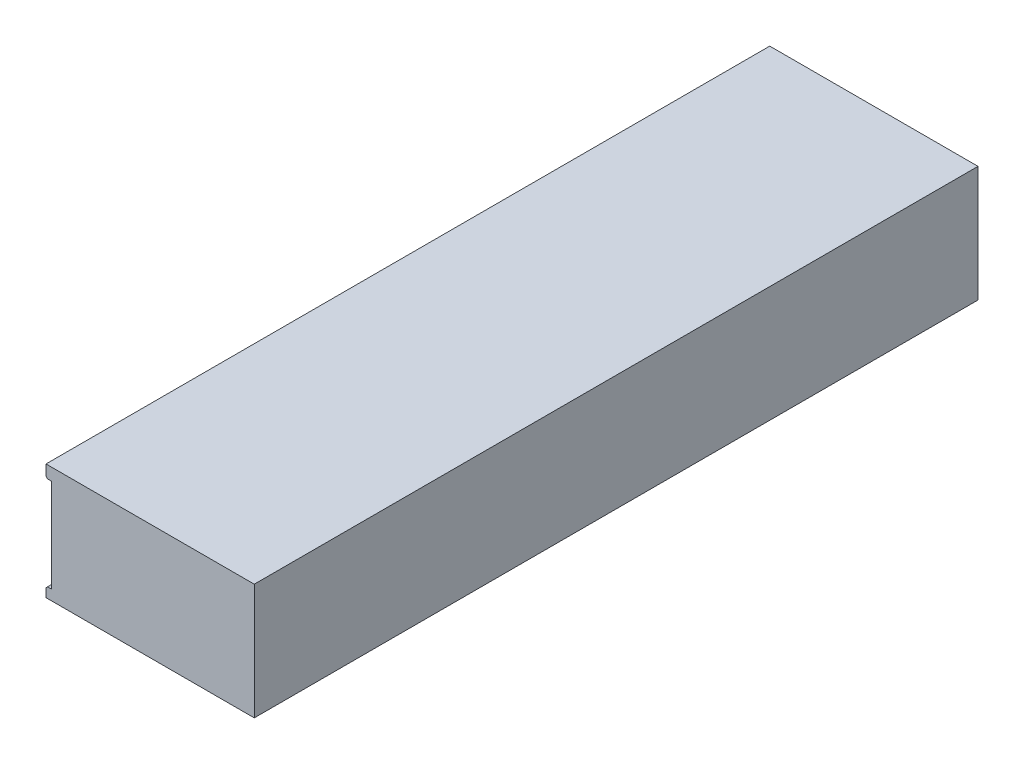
SolidWorks part; units mm, degrees
ref_plane "FRONT" through (0, 0, 0) normal (0, 0, 1) x (1, 0, 0)
ref_plane "TOP" through (0, 0, 0) normal (0, 1, 0) x (1, 0, 0)
ref_plane "RIGHT" through (0, 0, 0) normal (1, 0, 0) x (0, 0, -1)
sketch "Sketch1" plane through (0, 0, 0) normal (0, 0, 1) x (1, 0, 0)
  line L0 (50.673, 0) -> (50.673, -28.956)
  line L1 (50.673, -28.956) -> (-1.397, -28.956)
  line L2 (-1.397, -28.956) -> (-1.397, -26.416)
  line L3 (-1.397, -26.416) -> (0, -26.416)
  line L4 (0, -26.416) -> (0, -3.048)
  line L5 (0, -3.048) -> (-1.397, -3.048)
  line L6 (-1.397, -3.048) -> (-1.397, 0)
  line L7 (-1.397, 0) -> (50.673, 0)
  dimension "D1" = 52.07
  dimension "D2" = 50.673
  dimension "D3" = 3.048
  dimension "D4" = 2.54
  dimension "D5" = 28.956
extrude "Extrude1" add sketch "Sketch1" along normal mid plane 180.9496
sketch "Sketch2" plane through (0, 0, 0) normal (-1, 0, 0) x (0, 0, 1)
  line L1 (0, 0) -> (0, -28.956) construction
  line L2 (90.4748, -28.956) -> (-90.4748, -28.956) construction
  line L3 (0, -14.478) -> (26.0126, -14.478) construction
  point P0 (-85.598, -6.35)
  point P1 (85.598, -6.35)
  point P2 (4.8768, -6.35)
  point P4 (-4.8768, -6.35)
  point P9 (-4.8768, -23.114)
  point P12 (4.8768, -23.114)
  point P13 (85.598, -23.114)
  point P18 (-85.598, -23.114)
  dimension "D1" = 85.598
  dimension "D2" = 85.598
  dimension "D3" = 4.8768
  dimension "D4" = 8.128
  dimension "D5" = 8.636
hole_wizard "#10-32 Tapped Hole1" positions "3DSketch1" profile "Sketch3" tap size "#10-32" standard "Ansi Inch"
sketch3d "3DSketch1"
  point P0 (0, -6.35, -85.598)
  point P3 (0, -6.35, 85.598)
  point P6 (0, -6.35, 4.8768)
  point P9 (0, -6.35, -4.8768)
  point P12 (0, -23.114, -85.598)
  point P15 (0, -23.114, -4.8768)
  point P18 (0, -23.114, 4.8768)
  point P21 (0, -23.114, 85.598)
sketch "Sketch3" plane through (0, -6.35, -85.598) normal (0, 1, 0) x (0, 0, 1)
  line L0 (0, 0) -> (0, 11.2108)
  line L1 (0, 11.2108) -> (2.0193, 9.9974)
  line L2 (2.0193, 9.9974) -> (2.0193, 7.62)
  line L3 (2.0193, 7.62) -> (2.413, 7.62)
  line L4 (2.413, 7.62) -> (2.413, 0)
  line L5 (2.413, 0) -> (0, 0)
  line L10 (0, 11.2108) -> (-2.0193, 9.9974) construction
  line L11 (0, -6.35) -> (0, 107.95) construction
  dimension "Tap Drill Dia." = 4.0386
  dimension "Tap Drill Depth" = 9.9974
  dimension "Thread Major Dia." = 4.826
  dimension "Thread Depth" = 7.62
  dimension "Drill Angle" = 118
chamfer "Chamfer1" distance 0.381 angle 45 2 edges at (-1.397, -26.416, 0) (-1.397, -3.048, 0)
